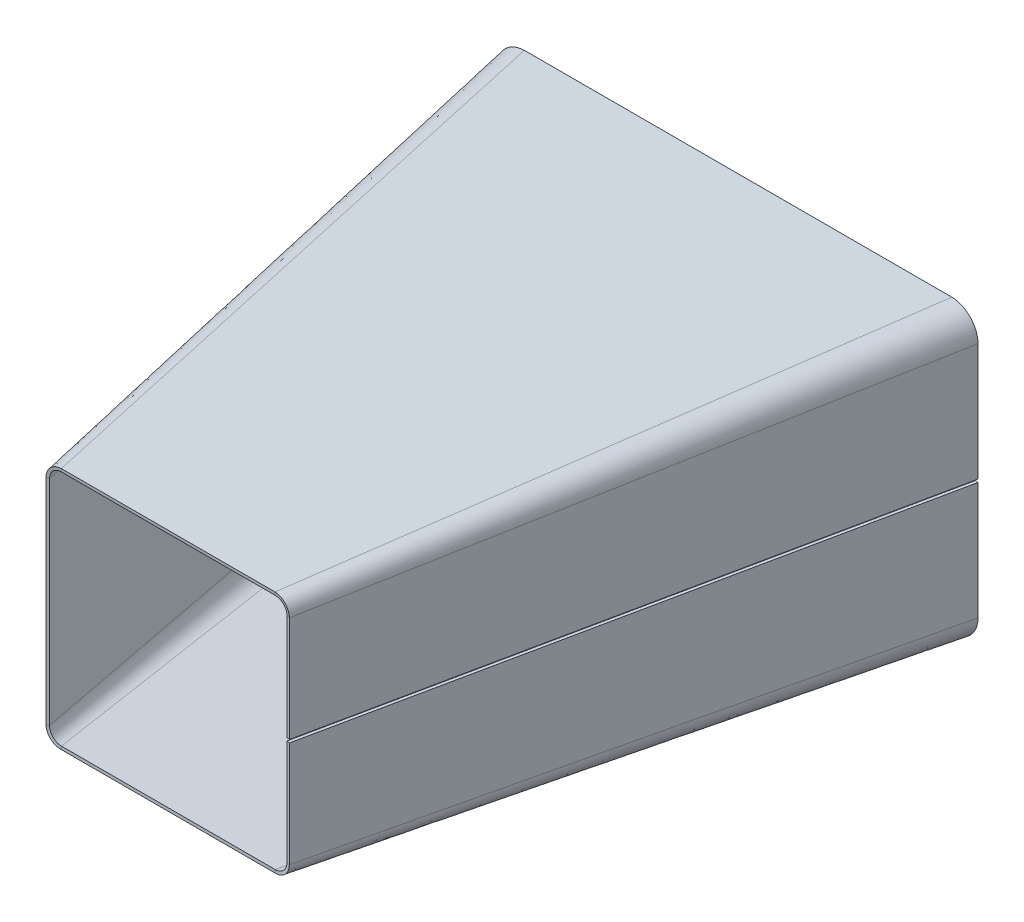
SolidWorks part; units mm, degrees
ref_plane "Plane1" through (0, 0, 0) normal (0, 0, 1) x (1, 0, 0)
ref_plane "Plane2" through (0, 0, 0) normal (0, 1, 0) x (1, 0, 0)
ref_plane "Plane3" through (0, 0, 0) normal (1, 0, 0) x (0, 0, -1)
sketch "ClipBoard" plane through (0, 0, 0) normal (1, 0, 0) x (0, 0, -1)
  line L0 (0, 0) -> (1.5875, 0) construction
  line L1 (0, 0) -> (0, 1.5875) construction
sketch "Inlet" plane through (0, 0, 0) normal (0, 0, 1) x (1, 0, 0)
  line L0 (0, 0) -> (107.95, 0) construction
  line L1 (-114.3, 76.2) -> (114.3, 76.2)
  line L2 (-127, 63.5) -> (-127, -63.5)
  line L3 (-114.3, -76.2) -> (114.3, -76.2)
  line L4 (127, 63.5) -> (127, 0.7937)
  line L5 (0, -0.7937) -> (134.62, -0.7937) construction
  line L6 (0, 0.7937) -> (134.62, 0.7937) construction
  line L7 (127, -0.7937) -> (127, -63.5)
  arc A0 (-127, 63.5) -> (-114.3, 76.2) centre (-114.3, 63.5) cw
  arc A1 (-114.3, -76.2) -> (-127, -63.5) centre (-114.3, -63.5) cw
  arc A2 (127, -63.5) -> (114.3, -76.2) centre (114.3, -63.5) cw
  arc A3 (114.3, 76.2) -> (127, 63.5) centre (114.3, 63.5) cw
  point P4 (0, 76.2)
  point P8 (-127, 76.2)
  point P13 (127, -76.2)
  point P16 (127, 76.2)
ref_plane "Exit Plane" through (0, 0, 304.8) normal (0, 0, 1) x (1, 0, 0)
sketch "Outlet" plane through (0, 0, 304.8) normal (0, 0, 1) x (1, 0, 0)
  line L0 (0, 0.7937) -> (134.62, 0.7937) construction
  line L1 (0, -0.7937) -> (134.62, -0.7937) construction
  line L2 (0, 0.7937) -> (134.62, 0.7937) construction
  line L3 (0, -0.7937) -> (134.62, -0.7937) construction
  line L4 (63.5, -0.7937) -> (63.5, -57.15)
  line L5 (-57.15, 63.5) -> (57.15, 63.5)
  line L6 (-63.5, 57.15) -> (-63.5, -57.15)
  line L7 (-57.15, -63.5) -> (57.15, -63.5)
  line L8 (63.5, 57.15) -> (63.5, 0.7937)
  arc A0 (-63.5, 57.15) -> (-57.15, 63.5) centre (-57.15, 57.15) cw
  arc A1 (-57.15, -63.5) -> (-63.5, -57.15) centre (-57.15, -57.15) cw
  arc A2 (63.5, -57.15) -> (57.15, -63.5) centre (57.15, -57.15) cw
  arc A3 (57.15, 63.5) -> (63.5, 57.15) centre (57.15, 57.15) cw
  point P9 (0, 63.5)
  point P10 (-63.5, 0)
  dimension "Corner Radius" = 6.35
sheet metal parameters "Sheet-Metal1" thickness 1.5875 parameters "D1"=0.1524
lofted bend "Transition" parameters "D1"=0, "Thickness"=1.5875, "D12"=1
other "Freeform Bend2" parameters "D1"=1000, "D4"=57.296, "D5"=1
other "Freeform Bend3" parameters "D1"=1000, "D4"=57.296, "D5"=2
other "Freeform Bend4" parameters "D1"=1000, "D4"=57.296, "D5"=3
other "Freeform Bend5" parameters "D1"=1000, "D4"=57.296, "D5"=4
flat pattern "Flat-Pattern1"
sketch "Bend-Lines1" plane through (0, 0, 0) normal (0, 1, 0) x (-1, 0, 0)
other "Flatten-<Freeform Bend2>1"
other "Flatten-<Freeform Bend3>1"
other "Flatten-<Freeform Bend4>1"
other "Flatten-<Freeform Bend5>1"
equation "\"Gap@ClipBoard\" = \"Thickness@ClipBoard\" * 1.0"
equation "\"HalfLength@Inlet\" = \"Lenth@Inlet\" / 2"
equation "\"HalfWidth@Inlet\" = \"Width@Inlet\" / 2"
equation "\"HalfGap@Inlet\" = \"Gap@ClipBoard\" / 2"
equation "\"Thickness@Transition\" = \"Thickness@ClipBoard\""
